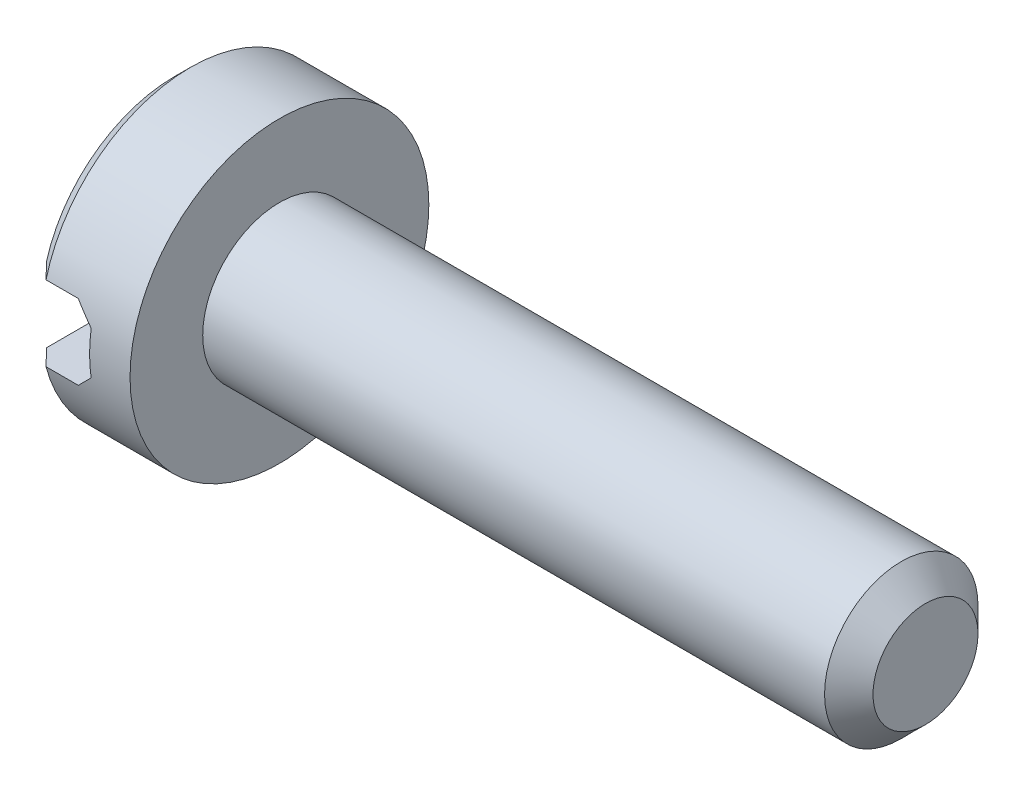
SolidWorks part; units mm, degrees
ref_plane "Face" through (0, 0, 0) normal (0, 0, 1) x (1, 0, 0)
ref_plane "Dessus" through (0, 0, 0) normal (0, 1, 0) x (1, 0, 0)
ref_plane "Droite" through (0, 0, 0) normal (1, 0, 0) x (0, 0, -1)
sketch "Esquisse1" plane through (0, 0, 0) normal (0, 0, 1) x (1, 0, 0)
  line L0 (0, 0) -> (0, 1.65)
  line L1 (0.2, 1.85) -> (1.3, 1.85)
  line L2 (1.3, 1.85) -> (1.3, 0)
  line L5 (0, 0) -> (7.6423, 0) construction
  line L7 (0, 1.65) -> (0.2, 1.85)
  line L8 (0, 0) -> (1.3, 0)
  point P1 (0, 1.85)
  dimension "D1" = 1.85
  dimension "D3" = 1.3
revolve "Révolution1" add sketch "Esquisse1" angle 360 about L5
sketch "Esquisse2" plane through (0, 0, 0) normal (0, 0, 1) x (1, 0, 0)
  line L0 (0, 1.65) -> (0, -1.65) construction
  line L1 (0, 0.4655) -> (0.6, 0.4655)
  line L2 (0, 0.4655) -> (0, -0.4655)
  line L3 (0, -0.4655) -> (0.6, -0.4655)
  line L4 (0.8, 0.2655) -> (0.8, -0.2655)
  line L5 (0.6, 0.4655) -> (0.8, 0.2655)
  line L6 (0.6, -0.4655) -> (0.8, -0.2655)
  point P1 (0.8, -0.4655)
  point P3 (0.8, 0.4655)
extrude "Enlèv. mat.-Extru.1" cut sketch "Esquisse2" against normal mid plane 10
sketch "Esquisse3" plane through (1.3, 0, 0) normal (1, 0, 0) x (0, 0, -1)
  circle A0 centre (0, 0) radius 0.95
extrude "Extrusion1" add sketch "Esquisse3" along normal blind 8
chamfer "Chanfrein1" distance 0.3 angle 45 1 edges at (9.3, 0, -0.95)
